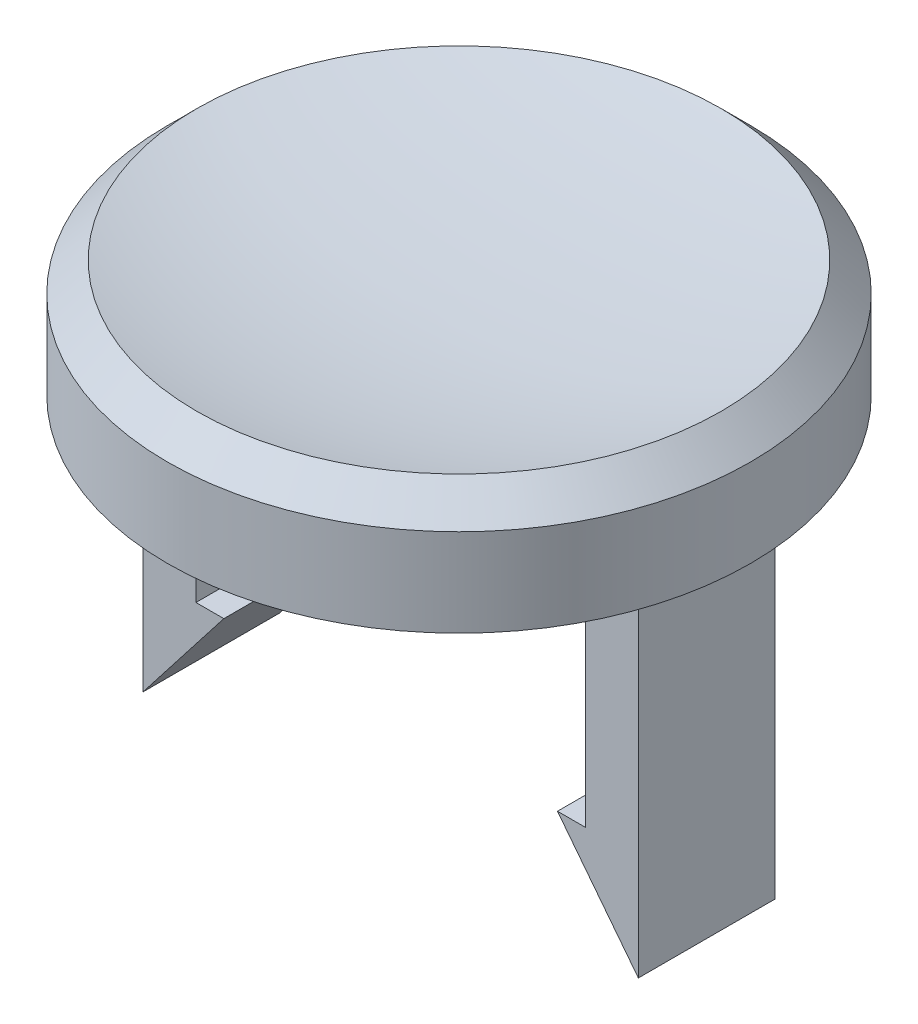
SolidWorks part; units mm, degrees
ref_plane "Front Plane" through (0, 0, 0) normal (0, 0, 1) x (1, 0, 0)
ref_plane "Top Plane" through (0, 0, 0) normal (0, 1, 0) x (1, 0, 0)
ref_plane "Right Plane" through (0, 0, 0) normal (1, 0, 0) x (0, 0, -1)
sketch "Sketch1" plane through (0, 0, 0) normal (0, 1, 0) x (1, 0, 0)
  circle A0 centre (0, 0) radius 10.45
  dimension "D1" = 20.9
extrude "Boss-Extrude1" add sketch "Sketch1" along normal blind 4.2
chamfer "Chamfer1" distance 1.05 angle 45 1 edges at (0, 4.2, 10.45)
sketch "Sketch2" plane through (0, 0, 0) normal (1, 0, 0) x (0, 0, -1)
  line L0 (-10.45, 3.15) -> (10.45, 3.15) construction
  line L1 (0, 3.15) -> (0, 5.0389) construction
  line L2 (-9.4, 4.2) -> (-1.6807, 4.9725)
  line L3 (-1.6807, 4.9725) -> (0, 4.5862)
  line L4 (0, 4.5862) -> (0, 3.15)
  spline S0 degree 2 poles (-9.4, 4.2) (-5.4838, 3.1728) (0, 3.15) knots 0 0 0 1 1 1
revolve "Cut-Revolve1" cut sketch "Sketch2" angle 360 about L1
sketch "Sketch3" plane through (0, 0, 0) normal (0, -1, 0) x (1, 0, 0)
  line L0 (0, 0) -> (0, -10.45) construction
  line L1 (-8.88, -2.45) -> (-6.98, -2.45)
  line L2 (-8.88, -2.45) -> (-8.88, 2.45)
  line L3 (-8.88, 2.45) -> (-6.98, 2.45)
  line L4 (-6.98, -2.45) -> (-6.98, 2.45)
  line L5 (-8.88, -2.45) -> (-6.98, 2.45) construction
  line L6 (-8.88, 2.45) -> (-6.98, -2.45) construction
  line L7 (0, 0) -> (-19.6371, 0) construction
  circle A0 centre (0, 0) radius 10.45 construction
  point P0 (-7.93, 0)
  dimension "D1" = 1.9
  dimension "D2" = 4.9
  dimension "D3" = 6.98
extrude "Boss-Extrude2" add sketch "Sketch3" along normal blind 8.7
sketch "Sketch4" plane through (0, 0, -2.45) normal (0, 0, -1) x (-1, 0, 0)
  line L0 (6.98, -8.7) -> (5.98, -8.7)
  line L1 (5.98, -8.7) -> (8.88, -12.4276)
  line L2 (8.88, -12.4276) -> (8.88, -8.7)
  line L3 (8.88, -8.7) -> (6.98, -8.7)
  line L4 (6.98, -8.7) -> (6.98, 0) construction
  dimension "D1" = 1
extrude "Boss-Extrude3" add sketch "Sketch4" against normal up to surface (4.9 mm away)
mirror "Mirror1" about plane through (0, 0, 0) normal (1, 0, 0) of "Boss-Extrude2", "Boss-Extrude3"
